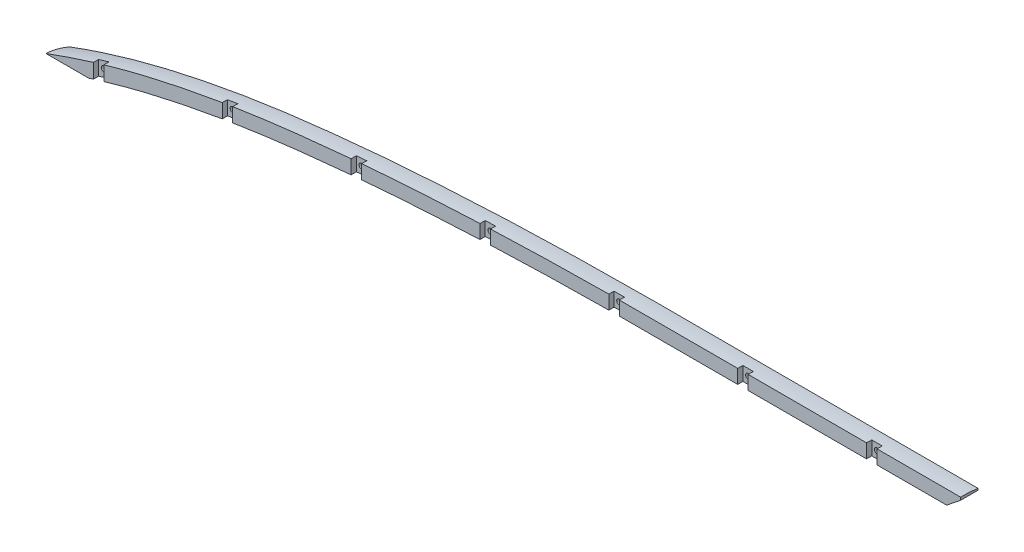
SolidWorks part; units mm, degrees
other "<0 Tail Flange Base Part Extended>-<#8-32 Tapped Hole1>"
ref_plane "Front Plane" through (0, 0, 0) normal (0, 0, 1) x (1, 0, 0)
ref_plane "Top Plane" through (0, 0, 0) normal (0, 1, 0) x (1, 0, 0)
ref_plane "Right Plane" through (0, 0, 0) normal (1, 0, 0) x (0, 0, -1)
inserted part "0 Tail Flange Base Part Extended"
hole_wizard "3/8 (0.375) Diameter Hole1" positions "Sketch2" profile "Sketch1" hole size "3/8" standard "ANSI Inch"
sketch "Sketch2" plane through (0, 0, -9.525) normal (0, 0, 1) x (1, 0, 0)
  point P0 (-936.6144, 145.9432)
  point P3 (-701.6644, 198.9768)
  point P6 (-466.7144, 227.2223)
  point P9 (-231.7644, 242.004)
  point P12 (3.1856, 247.6755)
  point P15 (238.1356, 247.7714)
  point P18 (473.0856, 247.65)
sketch "Sketch1" plane through (-936.6144, 145.9432, -9.525) normal (1, 0, 0) x (0, -1, 0)
  line L0 (0, 0) -> (0, 54.3155)
  line L1 (0, 54.3155) -> (4.7625, 54.3155)
  line L2 (4.7625, 54.3155) -> (4.7625, 0)
  line L5 (4.7625, 0) -> (0, 0)
  line L11 (0, -6.35) -> (0, 107.95) construction
  dimension "Thru Hole Dia." = 9.525
  dimension "Thru Hole Depth" = 54.3155
sketch "Sketch3" plane through (0, 0, -31.75) normal (0, 0, -1) x (-1, 0, 0)
  circle A0 centre (-473.0856, 247.65) radius 6.35
  circle A1 centre (-238.1356, 247.7714) radius 6.35
  circle A2 centre (-3.1856, 247.6755) radius 6.35
  circle A3 centre (231.7644, 242.004) radius 6.35
  circle A4 centre (466.7144, 227.2223) radius 6.35
  circle A5 centre (701.6644, 198.9768) radius 6.35
  circle A6 centre (936.6144, 145.9432) radius 6.35
  dimension "D1" = 12.7
extrude "Cut-Extrude1" cut sketch "Sketch3" against normal blind 6.35
sketch "Sketch4" plane through (0, 0, 0) normal (0, 0, 1) x (1, 0, 0)
  line L0 (635, 260.35) -> (635, 255.27)
  line L1 (635, 260.35) -> (635, 234.95) construction
  line L2 (635, 255.27) -> (609.6, 234.9499)
  line L3 (609.6, 234.9499) -> (609.6, 230.6302)
  line L4 (609.6, 230.6302) -> (638.1283, 230.6302)
  line L5 (638.1283, 230.6302) -> (638.1283, 260.35)
  line L6 (638.1283, 260.35) -> (635, 260.35)
  spline S0 degree 3 poles (634.9864, 234.95) (632.7181, 234.9512) (630.4459, 234.9511) (625.8937, 234.9503) (623.6125, 234.9498) (616.7733, 234.9493) (612.2158, 234.9497) (598.5491, 234.9505) (589.4361, 234.95) (562.0973, 234.9501) (543.8721, 234.9501) (511.3012, 234.9501) (496.9559, 234.9501) (482.6106, 234.9501) knots 0.912903 0.912903 0.912903 0.912903 0.916809 0.916809 0.920716 0.920716 0.928528 0.928528 0.944153 0.944153 0.975403 0.975403 1 1 1 1 construction
  dimension "D1" = 5.08
  dimension "D2" = 25.4
extrude "Cut-Extrude2" cut sketch "Sketch4" against normal through all
